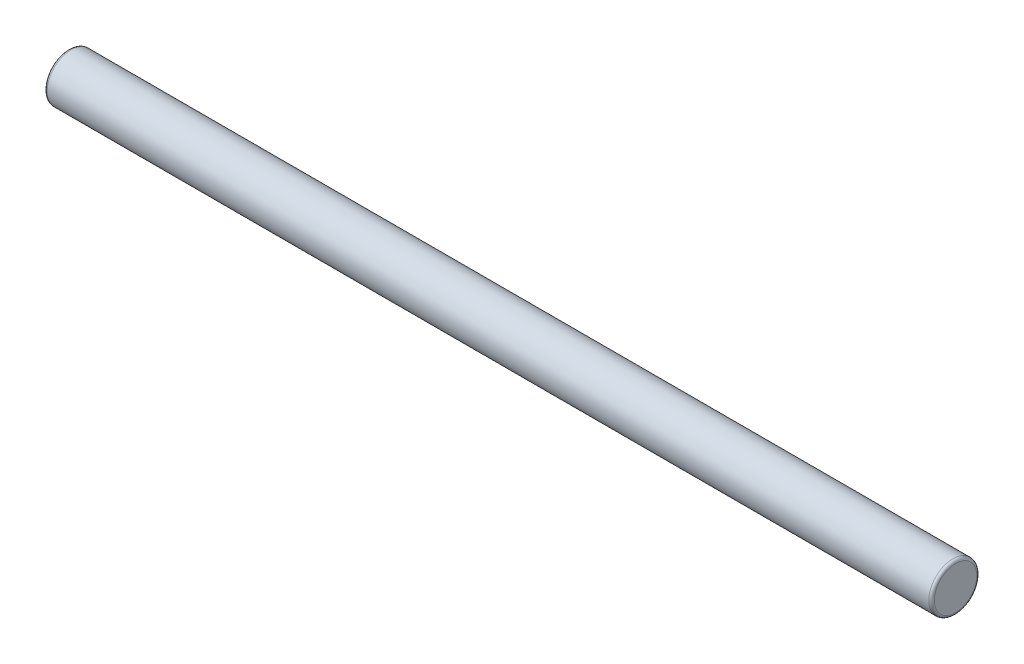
SolidWorks part; units mm, degrees
ref_plane "Front" through (0, 0, 0) normal (0, 0, 1) x (1, 0, 0)
ref_plane "Top" through (0, 0, 0) normal (0, 1, 0) x (1, 0, 0)
ref_plane "Right" through (0, 0, 0) normal (1, 0, 0) x (0, 0, -1)
sketch "Schizzo1" plane through (0, 0, 0) normal (0, 0, 1) x (1, 0, 0)
  line L0 (-323, 0) -> (323, 0) construction
  line L1 (-323, 0) -> (-323, 17.5)
  line L2 (-323, 17.5) -> (323, 17.5)
  line L3 (323, 17.5) -> (323, 0)
  line L4 (-323, 0) -> (323, 0)
  point P3 (0, 0)
  dimension "D1" = 35
  dimension "D2" = 646
revolve "Rivoluzione1" add sketch "Schizzo1" angle 360 about L0
fillet "Raccordo1" radius 2 2 edges at (-323, -17.5, 0) (323, -17.5, 0)
